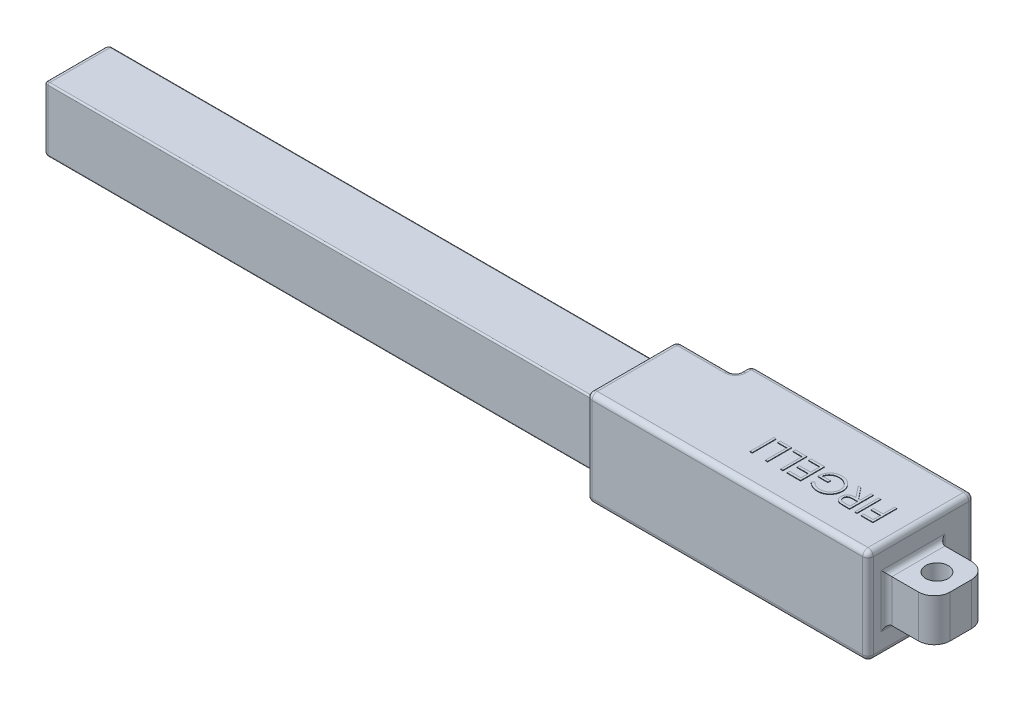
SolidWorks part; units mm, degrees
ref_plane "Front Plane" through (0, 0, 0) normal (0, 0, 1) x (1, 0, 0)
ref_plane "Top Plane" through (0, 0, 0) normal (0, 1, 0) x (1, 0, 0)
ref_plane "Right Plane" through (0, 0, 0) normal (1, 0, 0) x (0, 0, -1)
sketch "Sketch1" plane through (0, 0, 0) normal (0, 1, 0) x (1, 0, 0)
  line L0 (0, 0) -> (-52, 0)
  line L1 (-53, 1) -> (-53, 2.5)
  line L2 (-53, 2.5) -> (-157, 2.5)
  line L3 (-158, 3.5) -> (-158, 13.5)
  line L4 (-157, 14.5) -> (-53, 14.5)
  line L5 (-53, 14.5) -> (-53, 16)
  line L6 (-52, 17) -> (-43, 17)
  line L7 (-42, 18) -> (-42, 19)
  line L8 (-41, 20) -> (-1, 20)
  line L9 (0, 19) -> (0, 14.5)
  line L10 (1, 13.5) -> (6, 13.5)
  line L11 (9, 10.5) -> (9, 6.5)
  line L12 (6, 3.5) -> (1, 3.5)
  line L13 (0, 2.5) -> (0, 0)
  line L14 (9, 3.5) -> (0, 13.5) construction
  line L15 (-158, 8.5) -> (4.5, 8.5) construction
  circle A0 centre (4.5, 8.5) radius 2.125
  arc A1 (6, 3.5) -> (9, 6.5) centre (6, 6.5) ccw
  arc A2 (9, 10.5) -> (6, 13.5) centre (6, 10.5) ccw
  arc A3 (1, 3.5) -> (0, 2.5) centre (1, 2.5) ccw
  arc A4 (0, 14.5) -> (1, 13.5) centre (1, 14.5) ccw
  arc A5 (-157, 2.5) -> (-158, 3.5) centre (-157, 3.5) cw
  arc A6 (-158, 13.5) -> (-157, 14.5) centre (-157, 13.5) cw
  arc A7 (-43, 17) -> (-42, 18) centre (-43, 18) ccw
  arc A8 (-42, 19) -> (-41, 20) centre (-41, 19) cw
  arc A9 (-52, 17) -> (-53, 16) centre (-52, 16) ccw
  arc A10 (-52, 0) -> (-53, 1) centre (-52, 1) cw
  arc A11 (0, 19) -> (-1, 20) centre (-1, 19) ccw
  point P22 (9, 13.5)
  point P25 (0, 3.5)
  point P31 (-158, 2.5)
  point P34 (-158, 14.5)
  point P37 (-42, 17)
  point P40 (-42, 20)
  point P43 (-53, 17)
  point P46 (-53, 0)
  point P49 (0, 20)
  dimension "D10" = 4.25
  dimension "D13" = 3
  dimension "D14" = 1
  dimension "D15" = 1
  dimension "D16" = 1
  dimension "D2" = 4.5
  dimension "D1" = 53
  dimension "D3" = 17
  dimension "D4" = 20
  dimension "D5" = 3
  dimension "D6" = 12
  dimension "D7" = 10
  dimension "D9" = 6.5
  dimension "D11" = 162.5
  dimension "D12" = 42
  dimension "D17" = 9
extrude "Boss-Extrude1" add sketch "Sketch1" along normal mid plane 18
sketch "Sketch2" plane through (0, 0, 0) normal (0, 0, 1) x (1, 0, 0)
  line L0 (0, 0) -> (9, 0) construction
  line L1 (0, 9) -> (0, -9) construction
  line L2 (9, 9) -> (9, -9) construction
  line L3 (9, 0) -> (9, 9) construction
  line L4 (9, 9) -> (-158, 9) construction
  line L5 (-158, 9) -> (-158, -9) construction
  line L6 (-158, -9) -> (9, -9) construction
  line L7 (9, -9) -> (9, 0) construction
  line L8 (0, 8) -> (0, 5)
  line L9 (1, 4) -> (9, 4)
  line L10 (9, 4) -> (9, -4)
  line L11 (9, -4) -> (1, -4)
  line L12 (0, -5) -> (0, -8)
  line L13 (-1, -9) -> (-52, -9)
  line L14 (-53, -8) -> (-53, -6)
  line L15 (-53, -6) -> (-157, -6)
  line L16 (-158, -5) -> (-158, 5)
  line L17 (-157, 6) -> (-53, 6)
  line L18 (-53, 6) -> (-53, 8)
  line L19 (-52, 9) -> (-1, 9)
  line L20 (1, 9) -> (1, -9) construction
  arc A0 (-157, -6) -> (-158, -5) centre (-157, -5) cw
  arc A1 (-158, 5) -> (-157, 6) centre (-157, 5) cw
  arc A2 (-1, -9) -> (0, -8) centre (-1, -8) ccw
  arc A3 (0, -5) -> (1, -4) centre (1, -5) cw
  arc A4 (1, 4) -> (0, 5) centre (1, 5) cw
  arc A5 (0, 8) -> (-1, 9) centre (-1, 8) ccw
  arc A6 (-52, -9) -> (-53, -8) centre (-52, -8) cw
  arc A7 (-53, 8) -> (-52, 9) centre (-52, 8) cw
  point P30 (-158, -6)
  point P33 (-158, 6)
  point P36 (0, 0)
  point P39 (0, -4)
  point P42 (0, 5.5)
  point P45 (0, 9)
  point P48 (-53, -9)
  point P51 (-53, 9)
  dimension "D4" = 1
  dimension "D1" = 3.5
  dimension "D2" = 8
  dimension "D3" = 9.1241
  dimension "D5" = 53
  dimension "D6" = 10
  dimension "D7" = 104
extrude "Cut-Extrude1" cut sketch "Sketch2" against normal blind 20 flip side to cut
fillet "Fillet2" radius 1 7 edges at (-0.2929, 8.7071, -19.7071) (-52.7071, 8.7071, -16.7071) (-47.5, 9, -17) (-42.2929, 9, -17.2929) (-42, 9, -18.5) (-41.7071, 9, -19.7071) (-21, 9, -20)
fillet "Fillet3" radius 1 7 edges at (-52.7071, 8.7071, -0.2929) (-52.7071, -8.7071, -0.2929) (-26.5, -9, 0) (-0.2929, -8.7071, 0) (0, 0, 0) (-0.2929, 8.7071, 0) (-26.5, 9, 0)
fillet "Fillet4" radius 1 7 edges at (-0.2929, -8.7071, -19.7071) (-52.7071, -8.7071, -16.7071) (-47.5, -9, -17) (-42.2929, -9, -17.2929) (-42, -9, -18.5) (-41.7071, -9, -19.7071) (-21, -9, -20)
sketch "Sketch3" plane through (-158, 0, 0) normal (-1, 0, 0) x (0, 0, 1)
  line L0 (-13.5, -5) -> (-3.5, 5) construction
  circle A0 centre (-8.5, 0) radius 4.5
  dimension "D1" = 9
extrude "Cut-Extrude2" cut sketch "Sketch3" against normal blind 50
fillet "Fillet5" radius 0.3 8 edges at (-157.7071, -5.7071, -2.7929) (-157.7071, 5.7071, -2.7929) (-157.7071, -5.7071, -14.2071) (-157.7071, 5.7071, -14.2071) (-105, -6, -2.5) (-105, 6, -2.5) (-105, -6, -14.5) (-105, 6, -14.5)
sketch "Sketch4" plane through (0, -9, 0) normal (0, -1, 0) x (1, 0, 0)
  line L0 (-1, -10) -> (-4, -10) construction
  line L1 (-1, -19) -> (-1, -1) construction
  line L2 (-4, -10) -> (-35.2902, -10) construction
  text T0 "FIRGELLI" font "Century Gothic" height 4.5
extrude "Boss-Extrude2" add sketch "Sketch4" along normal blind 0.1
sketch "Sketch5" plane through (0, 9, 0) normal (0, 1, 0) x (1, 0, 0)
  line L0 (-1, 10) -> (-4, 10) construction
  line L1 (-1, 19) -> (-1, 1) construction
  line L2 (-4, 10) -> (-34.8589, 10) construction
  text T0 "FIRGELLI" font "Century Gothic" height 4.5
extrude "Boss-Extrude3" add sketch "Sketch5" along normal blind 0.1
ref_plane "Plane1" through (0, 0, 0) normal (0, -1, 0) x (-1, 0, 0)
